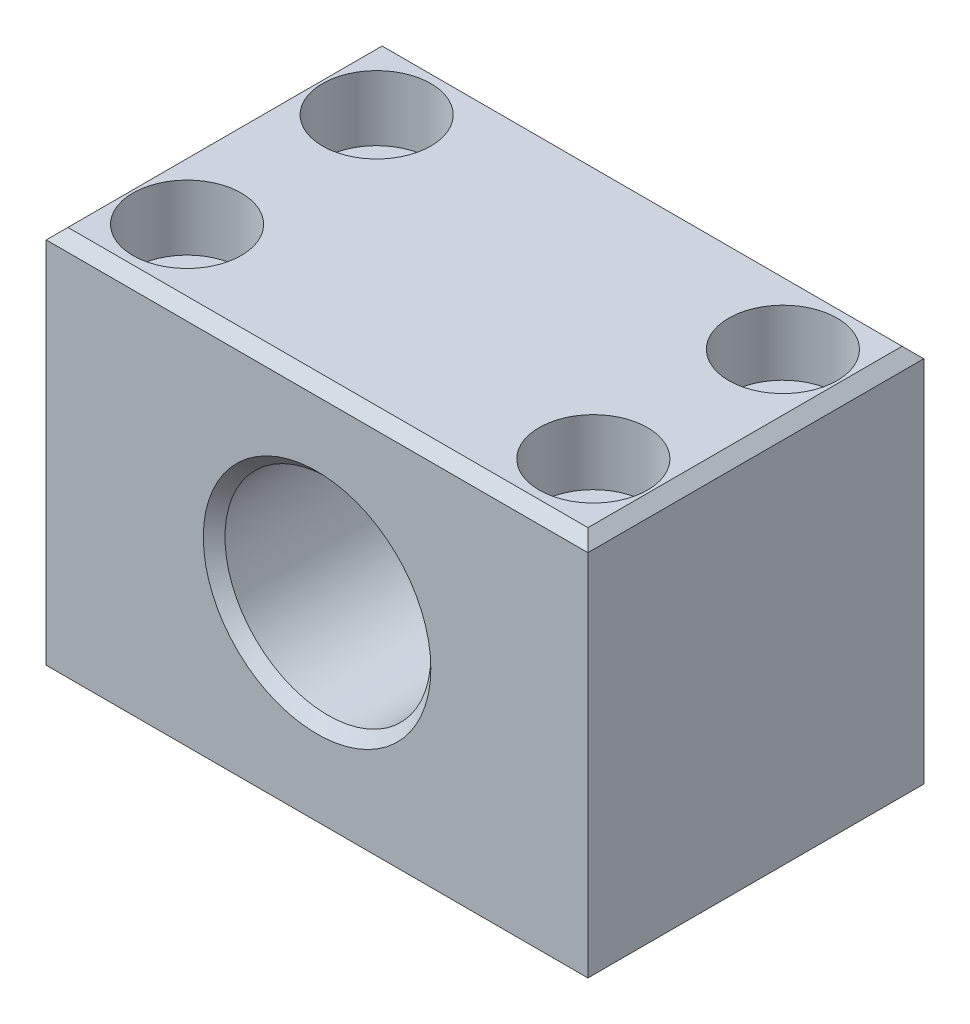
SolidWorks part; units mm, degrees
ref_plane "Plan de face" through (0, 0, 0) normal (0, 0, 1) x (1, 0, 0)
ref_plane "Plan de dessus" through (0, 0, 0) normal (0, 1, 0) x (1, 0, 0)
ref_plane "Plan de droite" through (0, 0, 0) normal (1, 0, 0) x (0, 0, -1)
sketch "Esquisse1" plane through (0, 0, 0) normal (0, 0, 1) x (1, 0, 0)
  line L1 (-50, 35) -> (50, 35)
  line L2 (-50, 35) -> (-50, -35)
  line L3 (-50, -35) -> (50, -35)
  line L4 (50, 35) -> (50, -35)
  point P4 (0, 35)
  point P5 (50, 0)
  dimension "D1" = 100
  dimension "D2" = 70
extrude "Boss.-Extru.1" add sketch "Esquisse1" along normal mid plane 62
sketch "Esquisse2" plane through (0, 0, 31) normal (0, 0, 1) x (1, 0, 0)
  circle A0 centre (0, 0) radius 19
  dimension "D1" = 38
extrude "Enlèv. mat.-Extru.1" cut sketch "Esquisse2" against normal through all
chamfer "Chanfrein1" distance 2 angle 45 6 edges at (19, 0, -31) (19, 0, 31) (50, 35, 0) (0, 35, 31) (-50, 35, 0) (0, 35, -31)
hole_wizard "Chambrage pour vis à tête hexagonale M121" positions "Esquisse4" profile "Esquisse3" counterbore size "M12" standard "Iso"
sketch "Esquisse4" plane through (0, 35, 0) normal (0, 1, 0) x (1, 0, 0)
  line L0 (-50, 31) -> (50, 31) construction
  line L1 (-50, -31) -> (-50, 31) construction
  point P0 (-37.5, 17.5)
  dimension "D1" = 13.5
  dimension "D2" = 12.5
sketch "Esquisse3" plane through (-37.5, 35, -17.5) normal (1, 0, 0) x (0, 0, 1)
  line L0 (0, 0) -> (0, 70)
  line L1 (0, 70) -> (6.1, 70)
  line L3 (6.1, 70) -> (6.1, 12)
  line L4 (6.1, 12) -> (10, 12)
  line L5 (10, 12) -> (10, 0)
  line L7 (10, 0) -> (0, 0)
  line L11 (0, -6.35) -> (0, 107.95) construction
  dimension "Diamètre du perçage jusqu'au prochain" = 12.2
  dimension "Profondeur du perçage jusqu'au prochain" = 70
  dimension "Diamètre du chambrage" = 20
  dimension "Profondeur du chambrage" = 12
pattern_linear "Répétition linéaire1" count 2 spacing 75 along (1, 0, 0) count 2 spacing 35 along (0, 0, 1) of "Chambrage pour vis à tête hexagonale M121"
